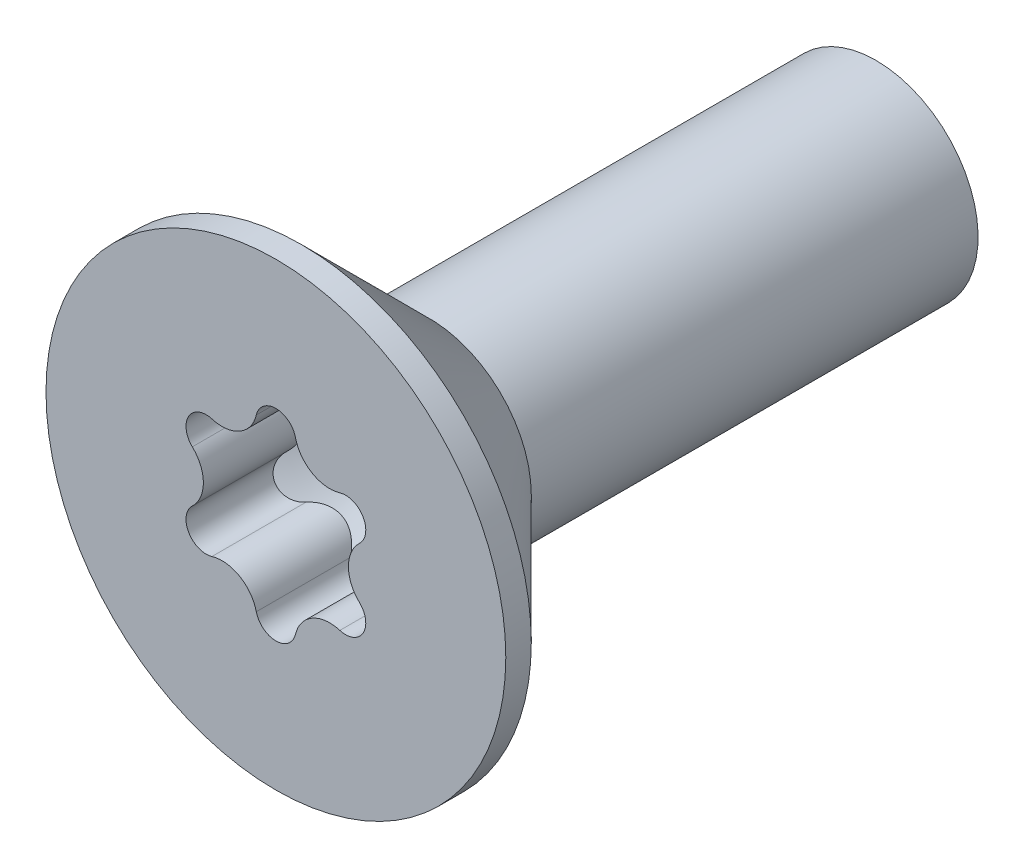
SolidWorks part; units mm, degrees
ref_plane "Front Plane" through (0, 0, 0) normal (0, 0, 1) x (1, 0, 0)
ref_plane "Top Plane" through (0, 0, 0) normal (0, 1, 0) x (1, 0, 0)
ref_plane "Right Plane" through (0, 0, 0) normal (1, 0, 0) x (0, 0, -1)
sketch "BodySke"
revolve "Base-Revolve" add sketch "BodySke" angle 360 about L0
sketch "PreBSke"
revolve "PreBroach" cut sketch "PreBSke" angle 360 about L0
sketch "HexSke"
extrude "Hexalobular" add sketch "HexSke" against normal up to next
sketch "ThdSchSke"
revolve "ThreadSchematic" cut sketch "ThdSchSke" angle 360 about L6
ref_plane "ThreadPlane" through (0, 0, -3.01) normal (0, 0, -1) x (-1, 0, 0)
pattern_linear "ThdSchPat" [suppressed] count 13
equation "\"MinorDia@ThreadCosmetic\" = \"MinorDia@ThdSchSke\""
equation "\"ThdLen@ThreadCosmetic\" = \"ThreadLength\""
equation "\"Ri@HexSke\"= .1 * \"A@PreBSke\""
equation "\"Re@HexSke\"= .175 * \"A@PreBSke\""
equation "\"ThreadLength\"= IIF ( \"B@BodySke\" = \"L@BodySke\" , \"L@BodySke\" - \"K@BodySke\" , \"B@BodySke\" )"
equation "\"ThdLen@ThreadPlane\"=\"ThreadLength\""
